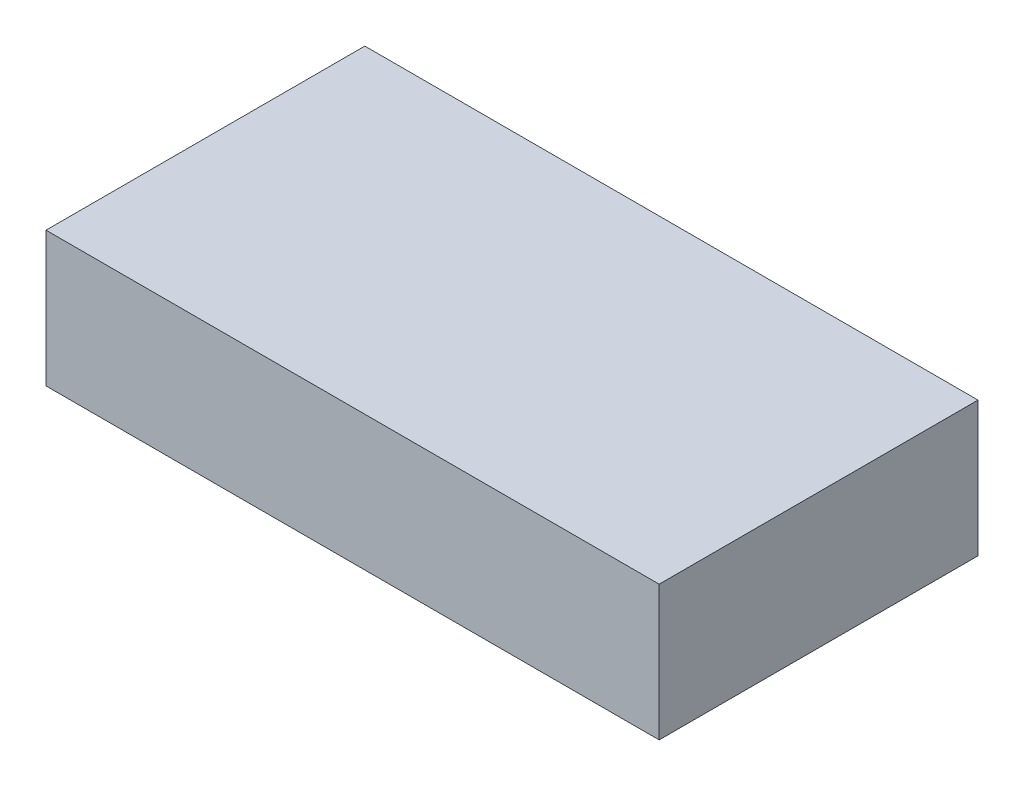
SolidWorks part; units mm, degrees
ref_plane "Front Plane" through (0, 0, 0) normal (0, 0, 1) x (1, 0, 0)
ref_plane "Top Plane" through (0, 0, 0) normal (0, 1, 0) x (1, 0, 0)
ref_plane "Right Plane" through (0, 0, 0) normal (1, 0, 0) x (0, 0, -1)
sketch "Sketch1" plane through (0, 0, 0) normal (0, 1, 0) x (1, 0, 0)
  line L1 (0, 0) -> (127, 0)
  line L2 (0, 0) -> (0, 66.04)
  line L3 (0, 66.04) -> (127, 66.04)
  line L4 (127, 0) -> (127, 66.04)
  dimension "D1" = 66.04
  dimension "D2" = 127
extrude "Boss-Extrude1" add sketch "Sketch1" along normal blind 27.94
